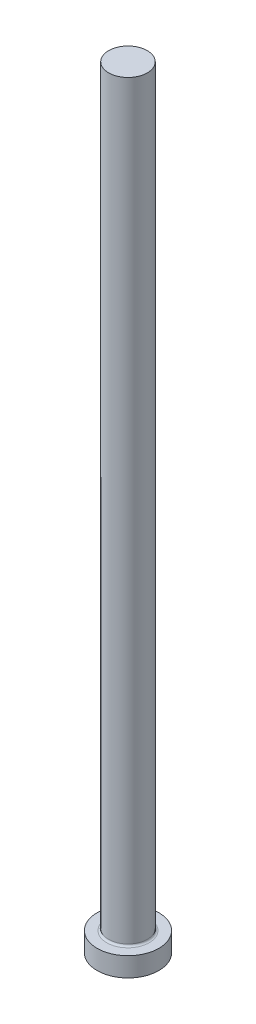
SolidWorks part; units mm, degrees
ref_plane "Plano frontal" through (0, 0, 0) normal (0, 0, 1) x (1, 0, 0)
ref_plane "Plano superior" through (0, 0, 0) normal (0, 1, 0) x (1, 0, 0)
ref_plane "Plano direito" through (0, 0, 0) normal (1, 0, 0) x (0, 0, -1)
sketch "Esboço1" plane through (0, 0, 0) normal (0, 0, 1) x (1, 0, 0)
  line L0 (0, 0) -> (8, 0)
  line L1 (8, 0) -> (8, 5)
  line L2 (8, 5) -> (5.5, 5)
  line L3 (5, 5.5) -> (5, 200)
  line L4 (5, 200) -> (0, 200)
  line L5 (0, 200) -> (0, 0) construction
  line L6 (0, 0) -> (0, 200)
  arc A0 (5.5, 5) -> (5, 5.5) centre (5.5, 5.5) cw
  dimension "D3" = 0.5
  dimension "D1" = 16
  dimension "D2" = 10
  dimension "D4" = 5
  dimension "D5" = 200
revolve "Revolução1" add sketch "Esboço1" angle 360 about L5
sketch "Esboço2"
  dimension "D1" = 0.9
  dimension "D2" = 1.4
  dimension "D3" = 4.3
  dimension "D4" = 0.6
wrap "Envolver1" sketch "Esboço2" wrap type deboss source sketch "Esboço2" thickness 0.1 parameters "D1"=0.1
